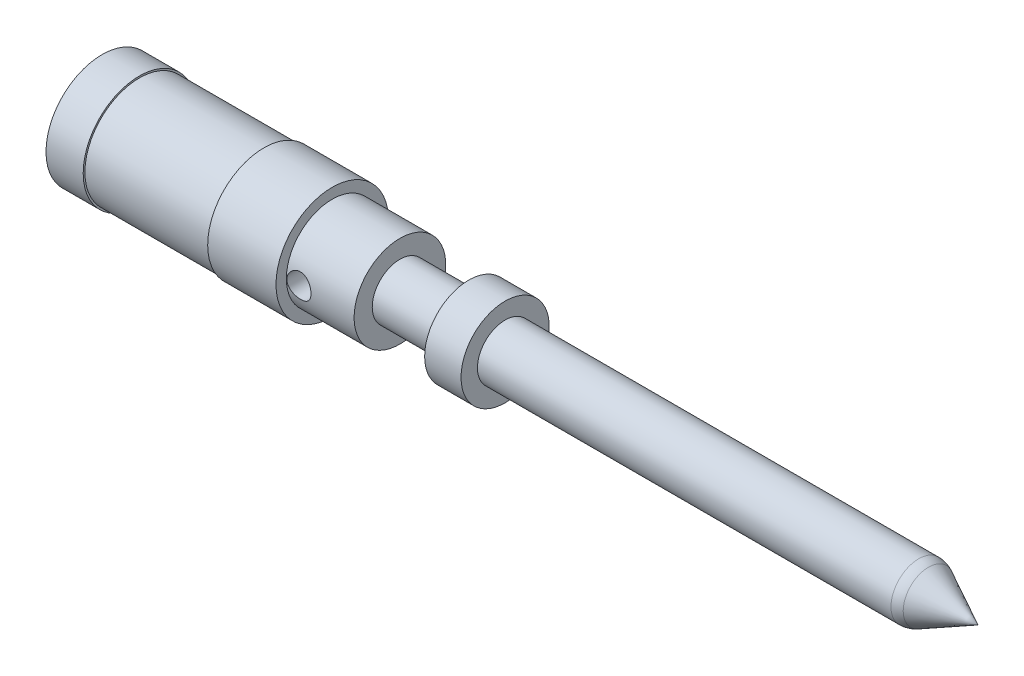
SolidWorks part; units mm, degrees
ref_plane "Front" through (0, 0, 0) normal (0, 0, 1) x (1, 0, 0)
ref_plane "Top" through (0, 0, 0) normal (0, 1, 0) x (1, 0, 0)
ref_plane "Right" through (0, 0, 0) normal (1, 0, 0) x (0, 0, -1)
sketch "Sketch1" plane through (0, 0, 0) normal (0, 0, 1) x (1, 0, 0)
  line L0 (0, 0) -> (70.1387, 0) construction
  line L1 (-0.7346, 1.651) -> (0.3576, 1.651)
  line L2 (0.3576, 1.651) -> (0.3576, 1.6002)
  line L3 (0.3576, 1.6002) -> (4.0152, 1.6002)
  line L4 (4.0152, 1.6002) -> (4.0152, 1.651)
  line L5 (4.0152, 1.651) -> (6.0218, 1.651)
  line L6 (6.0218, 1.651) -> (6.0218, 1.3462)
  line L7 (6.0218, 1.3462) -> (8.011, 1.3462)
  line L8 (8.011, 1.3462) -> (8.011, 0.8128)
  line L9 (10.033, 0.8128) -> (10.033, 1.2954)
  line L10 (10.033, 1.2954) -> (11.1018, 1.2954)
  line L11 (11.1018, 1.2954) -> (11.1018, 0.8128)
  line L12 (11.1018, 0.8128) -> (23.4031, 0.8128)
  line L13 (-0.7346, 1.651) -> (-0.7346, 0)
  line L14 (-0.7346, 0) -> (24.9936, 0)
  line L15 (8.011, 0.8128) -> (10.033, 0.8128)
  line L16 (23.4031, 0.8128) -> (24.9936, 0)
revolve "Revolve3" add sketch "Sketch1" angle 360 about L0
sketch "Sketch5" plane through (-0.7346, 0, 0) normal (-1, 0, 0) x (0, 0, 1)
  circle A0 centre (0, 0) radius 1.1303
extrude "Extrude1" cut sketch "Sketch5" against normal blind 5.9944
sketch "Sketch6" plane through (0, 0, 0) normal (0, 0, 1) x (1, 0, 0)
  circle A0 centre (6.3908, -0.0182) radius 0.3543
extrude "Extrude3" cut sketch "Sketch6" along normal blind 5.9944
fillet "Fillet4" radius 0.635 1 edges at (23.4031, 0, 0.8128)
